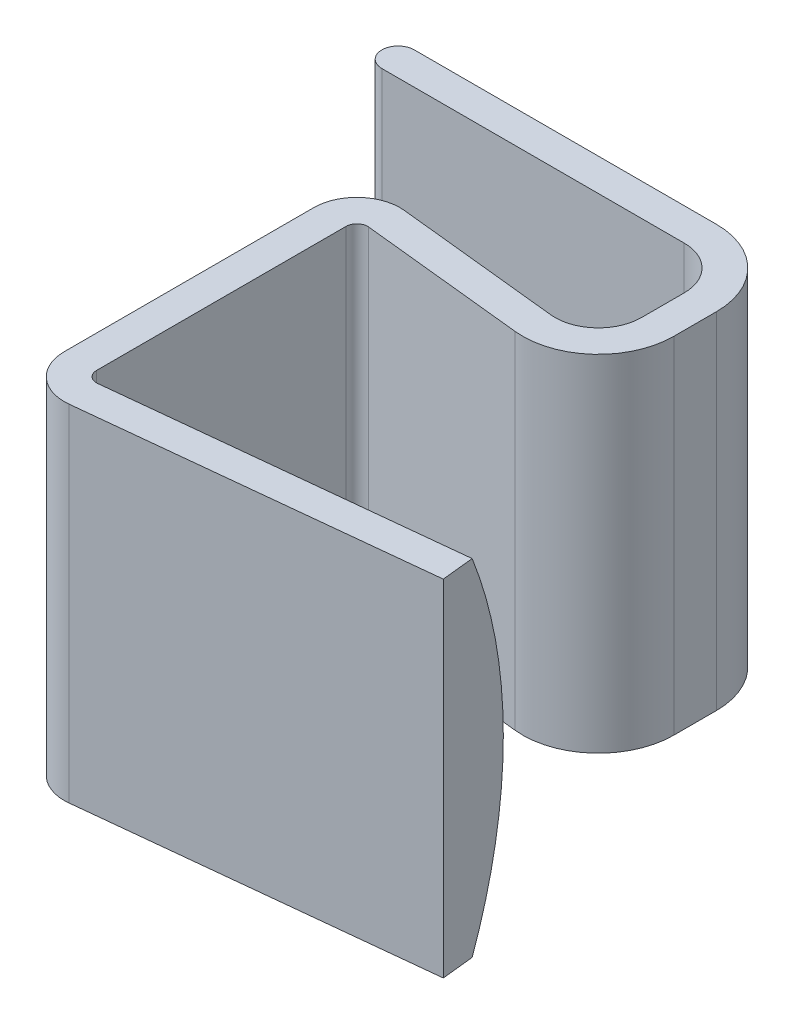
SolidWorks part; units mm, degrees
ref_plane "Front Plane" through (0, 0, 0) normal (0, 0, 1) x (1, 0, 0)
ref_plane "Top Plane" through (0, 0, 0) normal (0, 1, 0) x (1, 0, 0)
ref_plane "Right Plane" through (0, 0, 0) normal (1, 0, 0) x (0, 0, -1)
sketch "Sketch1" plane through (0, 0, 0) normal (0, 1, 0) x (1, 0, 0)
  line L0 (0.0846, 50.8381) -> (44.5346, 50.8381)
  line L1 (50.8846, 44.4881) -> (50.8846, 38.2055)
  line L2 (43.8708, 31.8903) -> (19.7983, 34.4204)
  line L3 (83.0997, 31.1531) -> (-36.6965, 31.1531) construction
  line L4 (12.7846, 28.1052) -> (12.7846, -8.59)
  line L5 (19.7983, -14.9053) -> (69.6215, -9.6686)
  line L6 (-9.1369, -15.6424) -> (93.1952, -15.6424) construction
  line L7 (0.0846, 55.6006) -> (44.5346, 55.6006)
  line L8 (55.6471, 44.4881) -> (55.6471, 38.2055)
  line L9 (43.373, 27.1539) -> (19.3005, 29.684)
  line L10 (17.5471, 28.1052) -> (17.5471, -8.59)
  line L11 (19.3005, -10.1688) -> (69.1237, -4.9322)
  line L12 (69.1237, -4.9322) -> (69.6215, -9.6686)
  arc A0 (12.7846, -8.59) -> (19.7983, -14.9053) centre (19.1346, -8.59) ccw
  arc A1 (19.7983, 34.4204) -> (12.7846, 28.1052) centre (19.1346, 28.1052) ccw
  arc A2 (50.8846, 38.2055) -> (43.8708, 31.8903) centre (44.5346, 38.2055) cw
  arc A3 (44.5346, 50.8381) -> (50.8846, 44.4881) centre (44.5346, 44.4881) cw
  arc A4 (44.5346, 55.6006) -> (55.6471, 44.4881) centre (44.5346, 44.4881) cw
  arc A5 (55.6471, 38.2055) -> (43.373, 27.1539) centre (44.5346, 38.2055) cw
  arc A6 (19.3005, 29.684) -> (17.5471, 28.1052) centre (19.1346, 28.1052) ccw
  arc A7 (17.5471, -8.59) -> (19.3005, -10.1688) centre (19.1346, -8.59) ccw
  arc A8 (0.0846, 50.8381) -> (0.0846, 55.6006) centre (0.0846, 53.2194) cw
  point P12 (12.7846, -15.6424)
  point P15 (12.7846, 35.1576)
  point P18 (50.8846, 31.1531)
  point P21 (50.8846, 50.8381)
  dimension "D8" = 6.35
  dimension "D1" = 38.1
  dimension "D2" = 6
  dimension "D3" = 19.685
  dimension "D4" = 50.8
  dimension "D5" = 50.8
  dimension "D6" = 57.15
  dimension "D7" = 6
  dimension "D9" = 4.7625
extrude "Boss-Extrude1" add sketch "Sketch1" along normal blind 50.8
sketch "Sketch2" plane through (67.8557, 0, -7.1319) normal (0.9945, 0, -0.1045) x (-0.1045, 0, -0.9945)
  line L0 (-12.1306, 50.8) -> (-12.1306, 0)
  arc A0 (-12.1306, 50.8) -> (-12.1306, 0) centre (-72.1591, 25.4) cw
extrude "Boss-Extrude2" add sketch "Sketch2" against normal up to next
